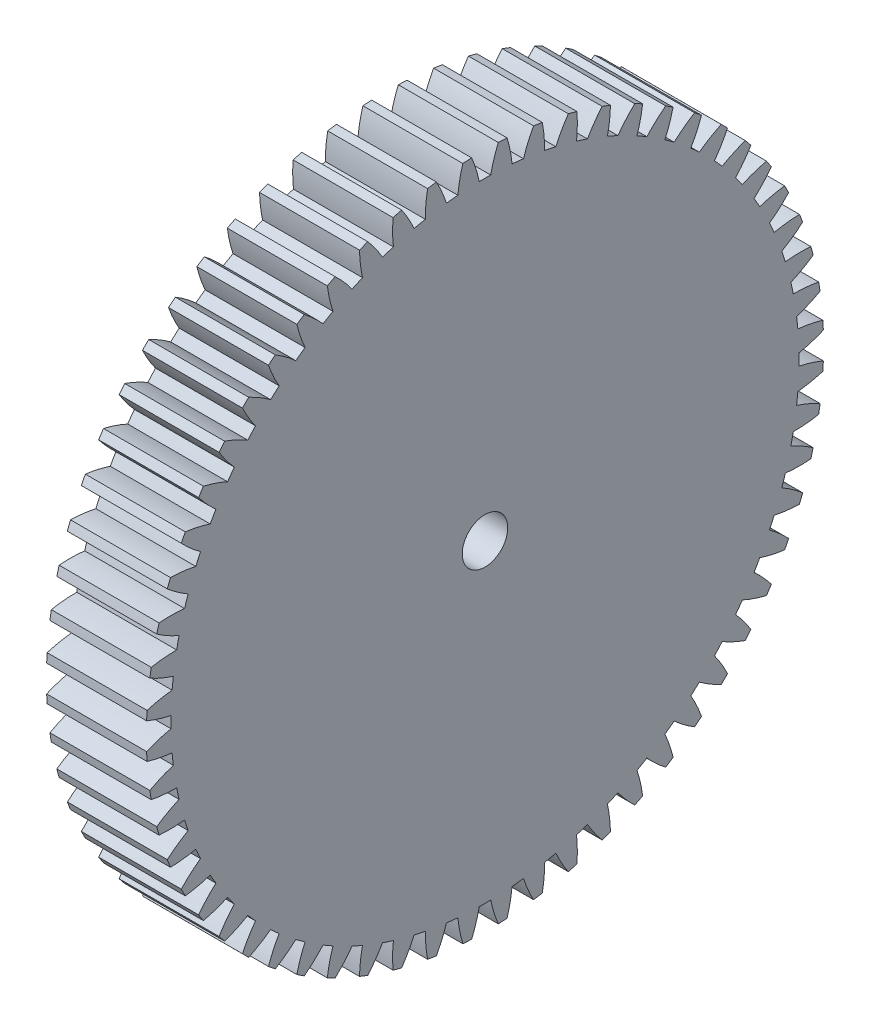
SolidWorks part; units mm, degrees
ref_plane "Plane1" through (0, 0, 0) normal (0, 0, 1) x (1, 0, 0)
ref_plane "Plane2" through (0, 0, 0) normal (0, 1, 0) x (1, 0, 0)
ref_plane "Plane3" through (0, 0, 0) normal (1, 0, 0) x (0, 0, -1)
other "Configuration Table"
sketch "HoldingSke" plane through (0, 0, 0) normal (0, 1, 0) x (1, 0, 0)
  line L0 (0, 0) -> (0.8333, -1.4434)
  line L1 (-15, 0) -> (100, 0) construction
  line L2 (0, 0) -> (-2.1039, 2.3779)
  line L3 (0, 0) -> (-11.863, 4.5341)
  line L4 (0, 0) -> (4.318, 7.479)
  line L5 (0, 0) -> (-46.8476, -17.4728)
  line L6 (0, 0) -> (-4.551, -3.0706)
  line L7 (-2.1039, 2.3779) -> (8.6586, 51.2059)
  line L8 (-76.2, 54.61) -> (-76.1, 54.61)
  line L9 (-67.7845, 28.3722) -> (-49.3413, 33.142)
  line L10 (-76.2, 71.12) -> (104.1128, 71.12)
  line L11 (0, 0) -> (-5.49, 0)
  line L12 (-76.2, 101.6) -> (-76.177, 101.6)
  line L13 (24.9733, 27.94) -> (52.9518, 28.4284)
  line L14 (24.9733, 27.94) -> (24.9743, 27.94)
  line L15 (24.9733, 27.94) -> (100.4006, 29.5858)
  line L16 (-63.627, -0.6) -> (-12.827, -0.6)
  circle A0 centre (0, 0) radius 0.4
  circle A1 centre (0, 0) radius 17.249
  circle A2 centre (0, 0) radius 37.5
  circle A3 centre (0, 0) radius 0.4
sketch "BasProSke" plane through (0, 0, 0) normal (0, 1, 0) x (1, 0, 0)
  line L0 (-10, 0) -> (60, 0) construction
  line L1 (0, 0) -> (0, 18.6)
  line L2 (0, 0) -> (5.49, 0)
  line L3 (5.49, 0) -> (5.49, 18.6)
  line L4 (5.49, 18.6) -> (0, 18.6)
revolve "Base-Revolve" add sketch "BasProSke" angle 360 about L0
sketch "TooCutSke" plane through (0, 0, 0) normal (1, 0, 0) x (0, 0, -1)
  line L1 (0, 0) -> (0, 107) construction
  line L2 (0, 0) -> (-0.5114, 17.9927) construction
  line L3 (0, 0) -> (-1.8836, 35.9404) construction
  line L4 (-0.5114, 17.9927) -> (-0.9418, 17.9702) construction
  arc A0 (0.3153, 17.2461) -> (-0.3153, 17.2461) centre (0, 0) ccw
  arc A1 (0.7414, 18.6106) -> (-0.7414, 18.6106) centre (0, 0) ccw
  circle A2 centre (0, 0) radius 18 construction
  circle A3 centre (0, 0) radius 17.4267 construction
  arc A4 (-0.3153, 17.2461) -> (-0.7414, 18.6106) centre (-7.3671, 15.7928) ccw
  arc A5 (0.7414, 18.6106) -> (0.3153, 17.2461) centre (7.3671, 15.7928) ccw
extrude "ToothCut" cut sketch "TooCutSke" along normal through all
fillet "Breaks" [suppressed] radius 0.012
fillet "RootFillets" [suppressed] radius 0.151
pattern_circular "TeethCuts" count 60 every 6 about axis through (-10, 0, 0) along (1, 0, 0) of "ToothCut", "RootFillets", "Breaks"
sketch "HubNeaOneSke" plane through (0, 0, 0) normal (-1, 0, 0) x (0, 0, 1)
  circle A0 centre (0, 0) radius 17.249
extrude "HubNearOne" [suppressed] add sketch "HubNeaOneSke" along normal blind 44.5101
sketch "HubNeaBotSke" plane through (0, 0, 0) normal (-1, 0, 0) x (0, 0, 1)
  circle A0 centre (0, 0) radius 17.249
extrude "HubNearBoth" [suppressed] add sketch "HubNeaBotSke" along normal blind 22.255
ref_plane "FarPln" through (5.49, 0, 0) normal (1, 0, 0) x (0, 0, -1)
sketch "HubFarSke" plane through (5.49, 0, 0) normal (1, 0, 0) x (0, 0, -1)
  circle A0 centre (0, 0) radius 17.249
extrude "HubFar" [suppressed] add sketch "HubFarSke" along normal blind 22.255
sketch "BorSke" plane through (0, 0, 0) normal (1, 0, 0) x (0, 0, -1)
  circle A0 centre (0, 0) radius 0.4
extrude "Bore" cut sketch "BorSke" along normal mid plane 100.0001
sketch "KeySke" plane through (0, 0, 0) normal (1, 0, 0) x (0, 0, -1)
  line L0 (-0.05, 0) -> (-0.05, 0.5)
  line L1 (-0.05, 0.5) -> (0.05, 0.5)
  line L2 (0.05, 0.5) -> (0.05, 0)
  line L3 (0, 0) -> (0, 34) construction
  line L4 (-0.05, 0) -> (0.05, 0)
extrude "Keyway" [suppressed] cut sketch "KeySke" along normal mid plane 100.0001
pattern_circular "Keyway2" [suppressed] count 2 every 90 about axis through (-10, 0, 0) along (1, 0, 0)
sketch "Sketch1" plane through (5.49, 0, 0) normal (1, 0, 0) x (0, 0, -1)
  circle A0 centre (0, 0) radius 1.25
  dimension "D1" = 2.5
extrude "Cut-Extrude1" cut sketch "Sketch1" against normal through all
equation "' \"Module@HoldingSke\" = 6.35"
equation "' \"Num_teeth@HoldingSke\" = 12"
equation "' \"Ap@HoldingSke\" =  20"
equation "' \"Ap@HoldingSke\" = 20"
equation "' \"Width@HoldingSke\" = 0.5 * 25.4"
equation "' \"Hub_dia@HoldingSke\"= 1 * 25.4"
equation "' \"Hub_dia@HoldingSke\" = 1 * 25.4"
equation "' \"Overall_len@HoldingSke\" = 1.0 * 25.4"
equation "' \"Bore@HoldingSke\" = 0.75 * 25.4"
equation "' \"T_dim@HoldingSke\" = 0.1 * 25.4"
equation "' \"Width@KeySke\" = 0.25 * 25.4"
equation "' \"Show_teeth@HoldingSke\" = 13"
equation "' \"Backlash@HoldingSke\" = 0.009 * 25.4"
equation "' \"Addendum_fac@HoldingSke\" = 1.0"
equation "' \"Dedendum_fac@HoldingSke\" = 1.25"
equation "' \"Dedendum_add@HoldingSke\" = 0.00005 * 25.4"
equation "' \"Clearance_fac@HoldingSke\" = 0.25"
equation "\"Pitch@HoldingSke\" = 1 / \"Module@HoldingSke\""
equation "\"Overcut_dia@TooCutSke\" = (\"Num_teeth@HoldingSke\" + 2 * \"Addendum_fac@HoldingSke\") / \"Pitch@HoldingSke\" + 0.002 * 25.4"
equation "\"Pitch_dia@TooCutSke\" = \"Num_teeth@HoldingSke\" / \"Pitch@HoldingSke\""
equation "\"Base_dia@TooCutSke\" = \"Num_teeth@HoldingSke\" / \"Pitch@HoldingSke\" * cos((\"Ap@HoldingSke\"  * 3.14159265 / 180))"
equation "\"Root_dia@TooCutSke\" = (\"Num_teeth@HoldingSke\" + 2) / \"Pitch@HoldingSke\" - 2 * (\"Addendum_fac@HoldingSke\" + \"Dedendum_fac@HoldingSke\") / \"Pitch@HoldingSke\" - \"Dedendum_add@HoldingSke\" * 2"
equation "\"Half_ang@TooCutSke\" = 180 / \"Num_teeth@HoldingSke\""
equation "\"Half_CT@TooCutSke\" = \"Num_teeth@HoldingSke\" / \"Pitch@HoldingSke\" * sin((3.14159265 / 2 / \"Num_teeth@HoldingSke\")) / 2 - 7 * \"Backlash@HoldingSke\" / 4"
equation "\"Flank_rad@TooCutSke\" = \"Num_teeth@HoldingSke\" / \"Pitch@HoldingSke\" / 5"
equation "\"Radius@RootFillets\" = \"Clearance_fac@HoldingSke\" / \"Pitch@HoldingSke\" + \"Dedendum_add@HoldingSke\""
equation "\"Break_rad@Breaks\" = 0.02 / \"Pitch@HoldingSke\""
equation "\"Thickness@HoldingSke\" = \"Width@HoldingSke\""
equation "\"OAL@HoldingSke\" = \"Thickness@HoldingSke\""
equation "\"MHD@HoldingSke\" = (\"Num_teeth@HoldingSke\" + 2) / \"Pitch@HoldingSke\" - 2 * (\"Addendum_fac@HoldingSke\" + \"Dedendum_fac@HoldingSke\")  / \"Pitch@HoldingSke\" - \"Dedendum_add@HoldingSke\" * 2"
equation "\"MBD@HoldingSke\" = (\"Num_teeth@HoldingSke\" + 2) / \"Pitch@HoldingSke\" - 2 * (\"Addendum_fac@HoldingSke\" + \"Dedendum_fac@HoldingSke\")  / \"Pitch@HoldingSke\" - \"Dedendum_add@HoldingSke\" * 2 - 0.002 * 25.4"
equation "\"MHD@HoldingSke\" = ((sgn( \"MHD@HoldingSke\" - \"Hub_dia@HoldingSke\" )-1)*( \"MHD@HoldingSke\" - \"Hub_dia@HoldingSke\" ))/-2+ \"Hub_dia@HoldingSke\""
equation "\"MBD@HoldingSke\" = ((sgn( \"MBD@HoldingSke\" - \"Bore@HoldingSke\" )-1)*( \"MBD@HoldingSke\" - \"Bore@HoldingSke\" ))/-2+ \"Bore@HoldingSke\""
equation "\"OAL@HoldingSke\" = ((sgn( \"OAL@HoldingSke\" - \"Overall_len@HoldingSke\" )+1)*( \"OAL@HoldingSke\" - \"Overall_len@HoldingSke\" ))/2 + \"Overall_len@HoldingSke\" + 0.000002 * 25.4"
equation "\"Num_teeth@TeethCuts\" = int( \"Show_teeth@HoldingSke\" ) + 1"
equation "\"Num_teeth@TeethCuts\" = ((sgn( \"Num_teeth@TeethCuts\" - \"Num_teeth@HoldingSke\" )-1)*( \"Num_teeth@TeethCuts\" - \"Num_teeth@HoldingSke\" ))/-2+ \"Num_teeth@HoldingSke\""
equation "\"Num_teeth@TeethCuts\" = ((sgn( \"Num_teeth@TeethCuts\" - 2.0)+1)*( \"Num_teeth@TeethCuts\" - 2.0))/2 +2.0"
equation "\"Angle@TeethCuts\" = 360.0 / \"Num_teeth@HoldingSke\""
equation "\"Diameter@BasProSke\" = (\"Num_teeth@HoldingSke\" + 2 * \"Addendum_fac@HoldingSke\") / \"Pitch@HoldingSke\""
equation "\"Thickness@BasProSke\"  = \"Thickness@HoldingSke\""
equation "' \"Fillet_rad@BasProSke\" =  \"Thickness@HoldingSke\" * 0.05"
equation "' \"Fillet_rad@BasProSke\" = \"Thickness@HoldingSke\" * 0.05"
equation "\"MHD@HoldingSke\" = ((sgn( \"MHD@HoldingSke\" - \"Root_dia@TooCutSke\" )-1)*( \"MHD@HoldingSke\" - \"Root_dia@TooCutSke\" ))/-2+ \"Root_dia@TooCutSke\""
equation "\"Diameter@HubNeaOneSke\" = \"MHD@HoldingSke\""
equation "\"Length@HubNearOne\" = \"OAL@HoldingSke\" - \"Thickness@BasProSke\""
equation "\"Diameter@HubNeaBotSke\" = \"MHD@HoldingSke\""
equation "\"Length@HubNearBoth\" = ( \"OAL@HoldingSke\" - \"Thickness@BasProSke\" ) / 2.0"
equation "\"Thickness@FarPln\" = \"Thickness@BasProSke\""
equation "\"Diameter@HubFarSke\" = \"MHD@HoldingSke\""
equation "\"Length@HubFar\" = ( \"OAL@HoldingSke\" - \"Thickness@BasProSke\" ) / 2.0"
equation "\"Diameter@BorSke\" = \"MBD@HoldingSke\""
equation "\"D1@Bore\" = \"OAL@HoldingSke\" * 2.0"
equation "\"D1@Keyway\" = \"OAL@HoldingSke\" * 2.0"
equation "\"Offset@KeySke\" = \"T_dim@HoldingSke\" + \"MBD@HoldingSke\" / 2.0"
